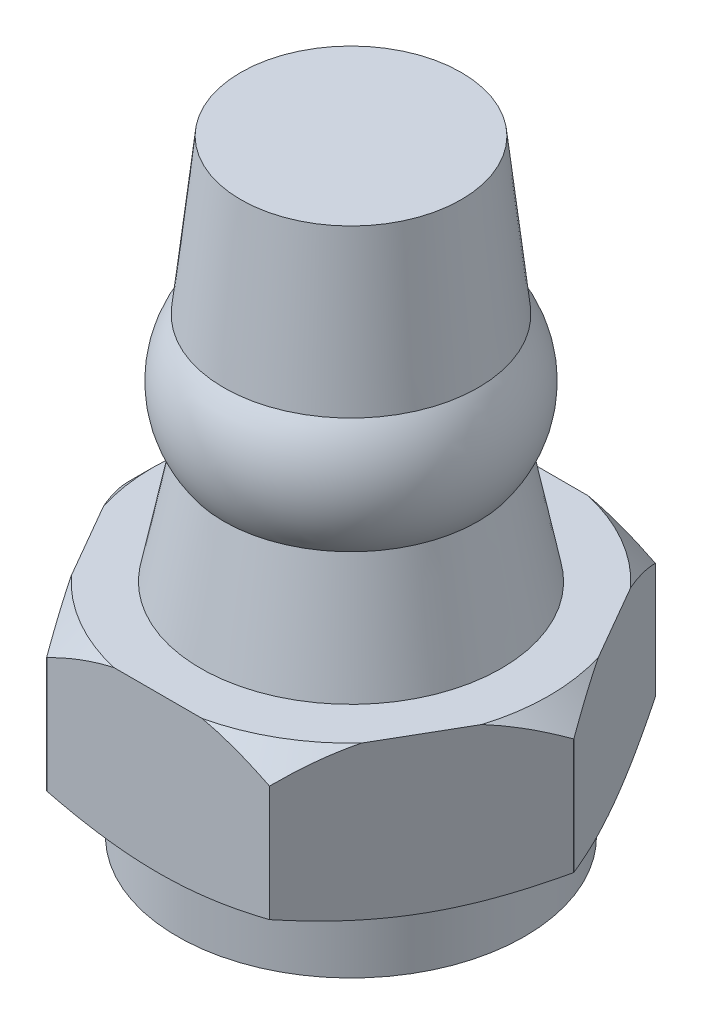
SolidWorks part; units mm, degrees
ref_plane "Plan de face" through (0, 0, 0) normal (0, 0, 1) x (1, 0, 0)
ref_plane "Plan de dessus" through (0, 0, 0) normal (0, 1, 0) x (1, 0, 0)
ref_plane "Plan de droite" through (0, 0, 0) normal (1, 0, 0) x (0, 0, -1)
sketch "Esquisse1" plane through (0, 0, 0) normal (0, 0, 1) x (1, 0, 0)
  line L0 (0, 11) -> (0, 0) construction
  line L1 (0, 11) -> (0, 0)
  line L20 (3.15, 0) -> (3.15, 1)
  line L24 (3.15, 0) -> (0, 0)
  line L28 (2.7273, 4) -> (2.3077, 6.1)
  line L30 (4.04, 1.45) -> (4.04, 3.55)
  line L31 (4.04, 3.55) -> (3.59, 4)
  line L32 (3.15, 1) -> (4.04, 1.45)
  line L37 (3.59, 4) -> (2.7273, 4)
  line L38 (2.3077, 8.2) -> (2, 11)
  line L39 (2, 11) -> (0, 11)
  arc A5 (2.3077, 6.1) -> (2.3077, 8.2) centre (0.8457, 7.15) ccw
  dimension "D10" = 1.8
  dimension "D1" = 2
  dimension "D2" = 7.15
  dimension "D3" = 3.15
  dimension "D4" = 1
  dimension "D5" = 4.04
  dimension "D6" = 2.1
  dimension "D7" = 4
  dimension "D9" = 2.1
  dimension "D11" = 2.8
  dimension "D12" = 11
  dimension "D13" = 1.45
  dimension "D14" = 2.3077
  dimension "D15" = 0.6364
revolve "Révolution1" add sketch "Esquisse1" angle 360 about L0
ref_plane "Plan1" through (0, 0, 3.5) normal (0, 0, 1) x (1, 0, 0)
sketch "Esquisse2" plane through (0, 0, 3.5) normal (0, 0, 1) x (1, 0, 0)
  line L1 (-3.235, 4.8947) -> (3.235, 4.8947)
  line L2 (-3.235, 4.8947) -> (-3.235, 0.5086)
  line L3 (-3.235, 0.5086) -> (3.235, 0.5086)
  line L4 (3.235, 4.8947) -> (3.235, 0.5086)
extrude "Enlèv. mat.-Extru.1" cut sketch "Esquisse2" along normal blind 10
pattern_circular "Répétition circulaire1" count 6 over 360 about axis through (0, 0, 0) along (0, 1, 0) of "Enlèv. mat.-Extru.1"
